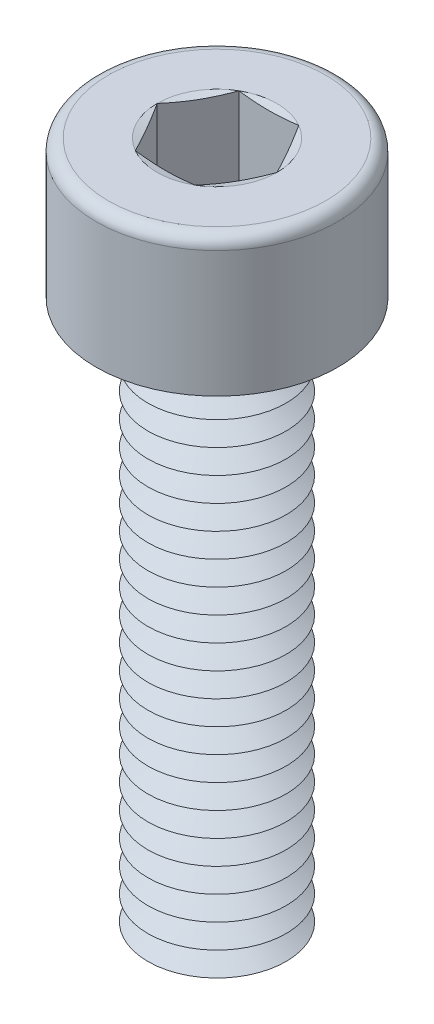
SolidWorks part; units mm, degrees
ref_plane "Front Plane" through (0, 0, 0) normal (0, 0, 1) x (1, 0, 0)
ref_plane "Top Plane" through (0, 0, 0) normal (0, 1, 0) x (1, 0, 0)
ref_plane "Right Plane" through (0, 0, 0) normal (1, 0, 0) x (0, 0, -1)
sketch "Sketch1" plane through (0, 0, 0) normal (0, 1, 0) x (1, 0, 0)
  circle A0 centre (0, 0) radius 2
  dimension "D1" = 4
extrude "Extrude1" add sketch "Sketch1" along normal blind 16
sketch "Sketch2" plane through (0, 16, 0) normal (0, 1, 0) x (1, 0, 0)
  circle A0 centre (0, 0) radius 3.5
  dimension "D1" = 7
extrude "Extrude2" add sketch "Sketch2" along normal blind 4
sketch "Sketch3" plane through (0, 20, 0) normal (0, 1, 0) x (1, 0, 0)
  line L1 (0.866, 1.5) -> (-0.866, 1.5)
  line L2 (-0.866, 1.5) -> (-1.7321, 0)
  line L3 (-1.7321, 0) -> (-0.866, -1.5)
  line L4 (-0.866, -1.5) -> (0.866, -1.5)
  line L5 (0.866, -1.5) -> (1.7321, 0)
  line L6 (1.7321, 0) -> (0.866, 1.5)
  circle A0 centre (0, 0) radius 1.5 construction
  dimension "D1" = 3
extrude "Extrude3" cut sketch "Sketch3" against normal blind 3
fillet "Fillet1" radius 0.35 1 edges at (0, 20, 3.5)
sketch "Sketch4" plane through (0, 0, 0) normal (1, 0, 0) x (0, 0, -1)
  line L0 (-1.5, 17) -> (0, 17)
  line L1 (0, 17) -> (0, 16.134)
  line L2 (0, 16.134) -> (-1.5, 17)
  dimension "D1" = 30
revolve "Cut-Revolve1" cut sketch "Sketch4" angle 360 about L1
sketch "Sketch5" plane through (0, 0, 0) normal (0, 0, 1) x (1, 0, 0)
  line L0 (-2, 0.35) -> (-2, -0.35)
  line L1 (-2, 16) -> (-2, 0) construction
  line L2 (-2, -0.35) -> (-1.3938, 0)
  line L3 (-2, 0) -> (2, 0) construction
  line L4 (-1.3938, 0) -> (-2, 0.35)
  dimension "D1" = 0.7
revolve "Cut-Revolve2" cut sketch "Sketch5" angle 360 about axis through (0, 16, 0) along (0, -1, 0)
pattern_linear "LPattern1" count 23 spacing 0.7 along (0, 1, 0) of "Cut-Revolve2"
sketch "Sketch6" plane through (0, 20, 0) normal (0, 1, 0) x (1, 0, 0)
  circle A0 centre (0, 0) radius 1.7321
extrude "Extrude4" cut sketch "Sketch6" against normal through all draft 75
